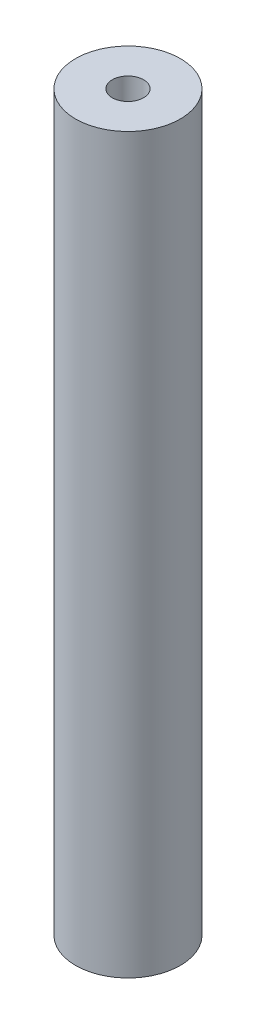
SolidWorks part; units mm, degrees
ref_plane "Front Plane" through (0, 0, 0) normal (0, 0, 1) x (1, 0, 0)
ref_plane "Top Plane" through (0, 0, 0) normal (0, 1, 0) x (1, 0, 0)
ref_plane "Right Plane" through (0, 0, 0) normal (1, 0, 0) x (0, 0, -1)
sketch "Sketch1" plane through (0, 0, 0) normal (0, 1, 0) x (1, 0, 0)
  circle A0 centre (0, 0) radius 6.35
  dimension "D1" = 12.7
extrude "Boss-Extrude1" add sketch "Sketch1" along normal blind 88.9 contours A0
hole_wizard "#10-24 Tapped Hole2" positions "Sketch2" profile "Sketch3" tap size "#10-24" standard "ANSI Inch"
sketch "Sketch2" plane through (0, 88.9, 0) normal (0, 1, 0) x (1, 0, 0)
  point P0 (0, 0)
sketch "Sketch3" plane through (0, 88.9, 0) normal (1, 0, 0) x (0, 0, 1)
  line L0 (0, 0) -> (0, 16.1268)
  line L1 (0, 16.1268) -> (1.8986, 14.986)
  line L2 (1.8986, 14.986) -> (1.8986, 0)
  line L5 (1.8986, 0) -> (0, 0)
  line L10 (0, 16.1268) -> (-1.8987, 14.986) construction
  line L11 (0, -6.35) -> (0, 107.95) construction
  dimension "Tap Drill Dia." = 3.7973
  dimension "Tap Drill Depth" = 14.986
  dimension "Drill Angle" = 118
hole_wizard "1/4-20 Tapped Hole1" positions "Sketch4" profile "Sketch5" tap size "1/4-20" standard "ANSI Inch"
sketch "Sketch4" plane through (0, 0, 0) normal (0, -1, 0) x (-1, 0, 0)
  point P0 (0, 0)
sketch "Sketch5" plane through (0, 0, 0) normal (1, 0, 0) x (0, 0, -1)
  line L0 (0, 0) -> (0, 20.5838)
  line L1 (0, 20.5838) -> (2.5527, 19.05)
  line L2 (2.5527, 19.05) -> (2.5527, 0)
  line L5 (2.5527, 0) -> (0, 0)
  line L10 (0, 20.5838) -> (-2.5527, 19.05) construction
  line L11 (0, -6.35) -> (0, 107.95) construction
  dimension "Tap Drill Dia." = 5.1054
  dimension "Tap Drill Depth" = 19.05
  dimension "Drill Angle" = 118
